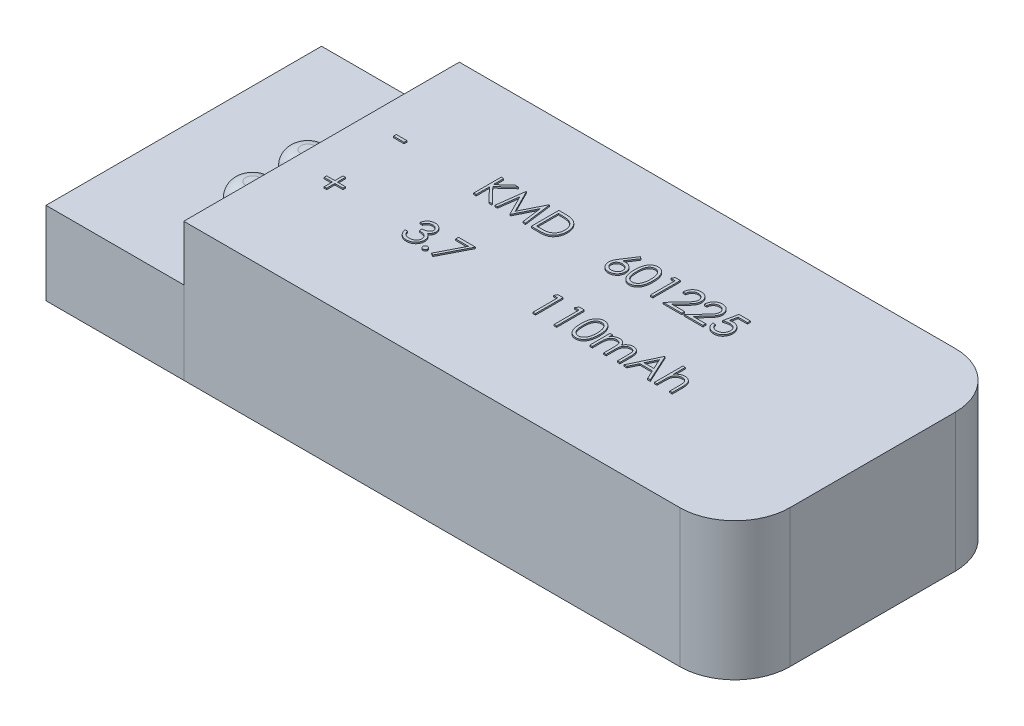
SolidWorks part; units mm, degrees
ref_plane "Front Plane" through (0, 0, 0) normal (0, 0, 1) x (1, 0, 0)
ref_plane "Top Plane" through (0, 0, 0) normal (0, 1, 0) x (1, 0, 0)
ref_plane "Right Plane" through (0, 0, 0) normal (1, 0, 0) x (0, 0, -1)
sketch "Sketch1" plane through (0, 0, 0) normal (0, 1, 0) x (1, 0, 0)
  line L1 (0, 0) -> (18, 0)
  line L2 (0, 0) -> (0, -10)
  line L3 (0, -10) -> (18, -10)
  line L4 (20, -2) -> (20, -8)
  arc A0 (18, -10) -> (20, -8) centre (18, -8) ccw
  arc A1 (18, 0) -> (20, -2) centre (18, -2) cw
  point P9 (20, 0)
extrude "Boss-Extrude1" add sketch "Sketch1" along normal blind 5
sketch "Sketch2" plane through (0, 0, 0) normal (0, 1, 0) x (1, 0, 0)
  line L1 (0, 0) -> (-5, 0)
  line L2 (0, 0) -> (0, -10)
  line L3 (0, -10) -> (-5, -10)
  line L4 (-5, 0) -> (-5, -10)
extrude "Boss-Extrude2" add sketch "Sketch2" along normal blind 3 separate body
sketch "Sketch4" plane through (0, 5, 0) normal (0, 1, 0) x (1, 0, 0)
  text T0 "-       KMD    601225  +      3.7       110mAh  " font "Century Gothic" height 1
  point P1 (1.169, -3.7955)
  point P2 (0, 0)
  point P3 (1.142, -4.3613)
  point P4 (0, 0)
  point P5 (1.1151, -3.4453)
  point P6 (1.142, -3.9033)
extrude "Boss-Extrude3" add sketch "Sketch4" along normal blind 0.05
sketch "Sketch5" plane through (0, 3, 0) normal (0, 1, 0) x (1, 0, 0)
  line L0 (0, -5) -> (-5, -5) construction
  line L1 (0, -10) -> (0, 0) construction
  line L2 (-5, 0) -> (-5, -10) construction
  line L3 (0, 0) -> (0, -10) construction
  circle A0 centre (-1.5, -4) radius 0.75
  circle A1 centre (-1.5, -6) radius 0.75
  dimension "D1" = 1.5
  dimension "D3" = 1.5
  dimension "D2" = 1
extrude "Boss-Extrude4" add sketch "Sketch5" along normal blind 0.5
fillet "Fillet2" radius 0.5 2 edges at (-1.5, 3.5, 4.75) (-1.5, 3.5, 5.25)
equation "\"battery length\"= 25mm"
equation "\"battery width\"= 10mm"
equation "\"battery thickness\"= 5mm"
equation "\"D2@Sketch1\"=\"battery width\""
equation "\"D1@Boss-Extrude1\"=\"battery thickness\""
equation "\"D1@Sketch2\"=\"battery width\""
